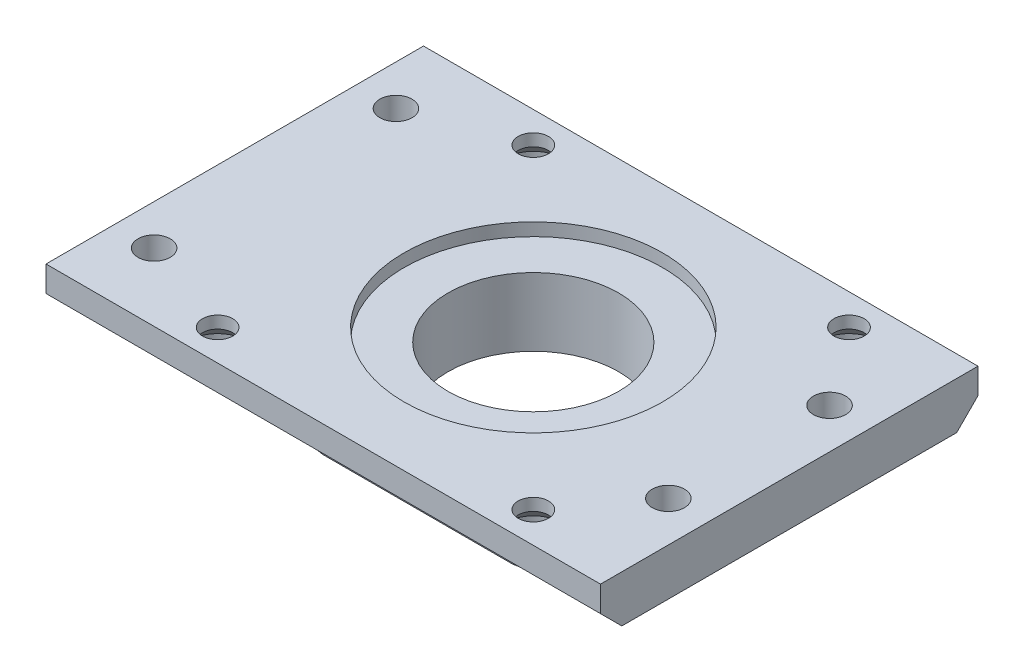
SolidWorks part; units mm, degrees
ref_plane "Front" through (0, 0, 0) normal (0, 0, 1) x (1, 0, 0)
ref_plane "Top" through (0, 0, 0) normal (0, 1, 0) x (1, 0, 0)
ref_plane "Right" through (0, 0, 0) normal (1, 0, 0) x (0, 0, -1)
sketch "Sketch1" plane through (0, 0, 0) normal (0, 1, 0) x (1, 0, 0)
  line L1 (0, 28.1) -> (-82.55, 28.1)
  line L2 (0, 28.1) -> (0, -28.1)
  line L3 (0, -28.1) -> (-82.55, -28.1)
  line L4 (-82.55, 28.1) -> (-82.55, -28.1)
  point P4 (0, 0)
  dimension "D1" = 56.2
  dimension "3.5" = 82.55
extrude "Boss-Extrude1" add sketch "Sketch1" along normal blind 12.065
sketch "Sketch2" plane through (0, 12.065, 0) normal (0, 1, 0) x (1, 0, 0)
  circle A0 centre (-38.1, 0) radius 12.7
  dimension "D1" = 25.4
  dimension "D2" = 38.1
extrude "Cut-Extrude1" cut sketch "Sketch2" against normal through all
hole_wizard "CSK for M4 Flat Head Machine Screw1" positions "Sketch20" profile "Sketch8" countersink size "M4" standard "ANSI Metric"
sketch "Sketch20" plane through (0, 0, 0) normal (0, -1, 0) x (-1, 0, 0)
  line L1 (14.6, 23.5) -> (61.6, 23.5)
  line L2 (14.6, 23.5) -> (14.6, -23.5)
  line L3 (14.6, -23.5) -> (61.6, -23.5)
  line L4 (61.6, 23.5) -> (61.6, -23.5)
  line L5 (61.6, 23.5) -> (14.6, -23.5)
  point P0 (14.6, 23.5)
  point P2 (61.6, -23.5)
  point P151 (14.6, -23.5)
  point P152 (61.6, 23.5)
  point P163 (38.1, 0)
  dimension "D1" = 47
sketch "Sketch8" plane through (-14.6, 0, -23.5) normal (1, 0, 0) x (0, 0, -1)
  line L0 (0, 0) -> (0, 12.065)
  line L1 (0, 12.065) -> (2.25, 12.065)
  line L2 (2.25, 12.065) -> (2.25, 10.255)
  line L3 (2.25, 10.255) -> (4.25, 8.255)
  line L4 (4.25, 8.255) -> (4.25, 0)
  line L6 (4.25, 0) -> (0, 0)
  line L7 (-2.25, 10.255) -> (-4.25, 8.255) construction
  line L11 (0, -6.35) -> (0, 107.95) construction
  dimension "Thru Hole Dia." = 4.5
  dimension "Thru Hole Depth" = 12.065
  dimension "C'Sink Dia." = 8.5
  dimension "C'Sink Angle" = 90
  dimension "Head Clearance" = 8.255
hole_wizard "M4 Clearance Hole1" positions "Sketch21" profile "Sketch4" hole size "M4" standard "ANSI Metric"
sketch "Sketch21" plane through (0, 12.065, 0) normal (0, 1, 0) x (1, 0, 0)
  line L4 (0, 0) -> (-82.55, 0) construction
  line L5 (-82.55, 28.1) -> (-82.55, -28.1) construction
  line L8 (0, -28.1) -> (0, 28.1) construction
  point P0 (-76.55, 18)
  point P2 (-6, 12)
  dimension "D1" = 36
  dimension "D2" = 6
  dimension "D3" = 6
  dimension "D4" = 12
sketch "Sketch4" plane through (-76.55, 12.065, -18) normal (1, 0, 0) x (0, 0, 1)
  line L0 (0, 0) -> (0, 12.065)
  line L1 (0, 12.065) -> (2.4, 12.065)
  line L2 (2.4, 12.065) -> (2.4, 0)
  line L5 (2.4, 0) -> (0, 0)
  line L11 (0, -6.35) -> (0, 107.95) construction
  dimension "Thru Hole Dia." = 4.8
  dimension "Thru Hole Depth" = 12.065
mirror "Mirror1" about plane through (0, 0, 0) normal (0, 0, 1) of "M4 Clearance Hole1"
sketch "Sketch9" plane through (0, 0, 0) normal (0, -1, 0) x (1, 0, 0)
  line L0 (-61.6, 23.5) -> (-61.6, -23.5) construction
  line L11 (-49.4858, 20) -> (-18.1, 20)
  line L12 (-18.1, 20) -> (-18.1, -20)
  line L13 (-18.1, -20) -> (-49.4858, -20)
  line L15 (-72.3036, 15.9766) -> (-72.3036, -15.9766)
  line L18 (-72.3036, 0) -> (-38.1, 0) construction
  line L19 (-72.3036, 15.9766) -> (-49.4858, 20)
  line L21 (-72.3036, -15.9766) -> (-49.4858, -20)
  point P3 (-72.3036, 0)
  point P5 (-18.1, 0)
  dimension "D1" = 20
  dimension "D2" = 40
  dimension "D3" = 54.2036
  dimension "D4" = 20
  dimension "D5" = 31.9532
extrude "Cut-Extrude3" cut sketch "Sketch9" against normal blind 5.08
fillet "Fillet2" radius 3.302 6 edges at (-18.1, 2.54, -20) (-18.1, 2.54, 20) (-49.4858, 2.54, -20) (-72.3036, 2.54, -15.9766) (-49.4858, 2.54, 20) (-72.3036, 2.54, 15.9766)
chamfer "Chamfer1" distance 3.175 angle 45 2 edges at (-41.275, 5.08, 28.1) (-41.275, 5.08, -28.1)
sketch "Sketch15" plane through (0, 12.065, 0) normal (0, 1, 0) x (1, 0, 0)
  circle A0 centre (-38.1, 0) radius 19.2405
  dimension "D1" = 38.481
extrude "Cut-Extrude4" cut sketch "Sketch15" against normal blind 1.905
